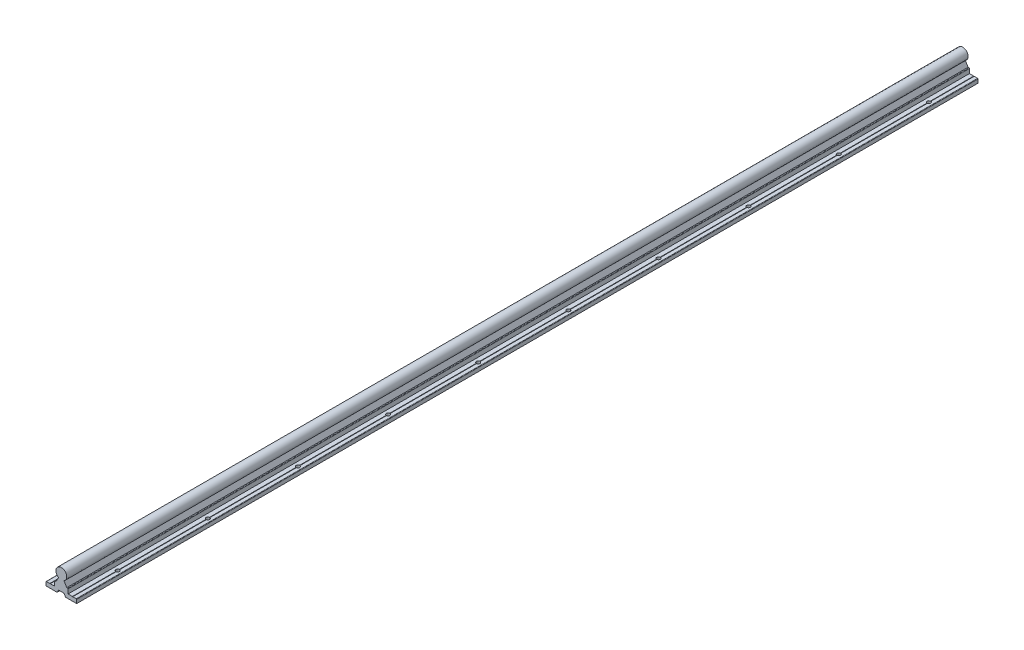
SolidWorks part; units mm, degrees
ref_plane "Front Plane" through (0, 0, 0) normal (0, 0, 1) x (1, 0, 0)
ref_plane "Top Plane" through (0, 0, 0) normal (0, 1, 0) x (1, 0, 0)
ref_plane "Right Plane" through (0, 0, 0) normal (1, 0, 0) x (0, 0, -1)
ref_plane "Plane1" through (0, 0, 0) normal (0, 0, -1) x (-1, 0, 0)
sketch "Sketch1" plane through (0, 0, 0) normal (0, 0, -1) x (-1, 0, 0)
  line L0 (-6.0022, -10.3962) -> (-17, -10.3962)
  line L1 (-17, -10.3962) -> (-17, -20.1962)
  line L2 (-17, -20.1962) -> (17, -20.1962)
  line L3 (17, -20.1962) -> (17, -10.3962)
  line L4 (17, -10.3962) -> (6.0022, -10.3962)
  line L5 (6.0022, -10.3962) -> (3, -5.1962)
  line L6 (-3, -5.1962) -> (-6.0022, -10.3962)
  arc A0 (3, -5.1962) -> (-3, -5.1962) centre (0, 0) ccw
  dimension "D1" = 6
  dimension "D2" = 10.9978
  dimension "D3" = 14
  dimension "D4" = 17
  dimension "D5" = 9.8
  dimension "D6" = 23.0022
  dimension "D7" = 34
  dimension "D8" = 15
extrude "Boss-Extrude1" add sketch "Sketch1" against normal blind 1000
sketch "Sketch2" plane through (0, 0, 1000) normal (0, 0, 1) x (1, 0, 0)
  line L0 (17, -10.3962) -> (7.5, -10.3962)
  line L1 (7.5, -10.3962) -> (7.5, -15.6962)
  line L2 (7.5, -15.6962) -> (17, -15.6962)
  line L3 (17, -15.6962) -> (17, -10.3962)
  line L4 (-17, -10.3962) -> (-6.0022, -10.3962) construction
  dimension "D1" = 1.4978
  dimension "D2" = 10.9978
  dimension "D3" = 5.3
extrude "Cut-Extrude1" cut sketch "Sketch2" against normal through all
sketch "Sketch3" plane through (0, 0, 1000) normal (0, 0, 1) x (1, 0, 0)
  line L0 (12.75, -15.6962) -> (12.25, -15.6962)
  line L1 (12.25, -15.6962) -> (12.5, -15.9462)
  line L2 (12.5, -15.9462) -> (12.75, -15.6962)
  line L3 (17, -15.6962) -> (17, -20.1962) construction
  line L4 (7.5, -15.6962) -> (17, -15.6962) construction
  dimension "D1" = 4.25
  dimension "D2" = 4.5
  dimension "D3" = 4.75
  dimension "D4" = 0.25
extrude "Cut-Extrude2" cut sketch "Sketch3" against normal through all
sketch "Sketch4" plane through (0, 0, 1000) normal (0, 0, 1) x (1, 0, 0)
  line L0 (12.25, -20.1962) -> (12.75, -20.1962)
  line L1 (12.75, -20.1962) -> (12.5, -19.9462)
  line L2 (12.5, -19.9462) -> (12.25, -20.1962)
  line L3 (7.5, -10.3962) -> (7.5, -15.6962) construction
  line L4 (7.5, -15.6962) -> (12.25, -15.6962) construction
  dimension "D1" = 4.75
  dimension "D2" = 5
  dimension "D3" = 5.25
  dimension "D4" = 4.25
  dimension "D5" = 4.5
extrude "Cut-Extrude3" cut sketch "Sketch4" against normal blind 400
sketch "Sketch5" plane through (0, 0, 1000) normal (0, 0, 1) x (1, 0, 0)
  line L0 (-4.7321, -20.1962) -> (4.7321, -20.1962)
  line L1 (4.7321, -20.1962) -> (3, -17.1962)
  line L2 (3, -17.1962) -> (-3, -17.1962)
  line L3 (-3, -17.1962) -> (-4.7321, -20.1962)
  line L4 (17, -15.6962) -> (17, -20.1962) construction
  line L5 (17, -20.1962) -> (12.75, -20.1962) construction
  dimension "D1" = 12.2679
  dimension "D2" = 14
  dimension "D3" = 20
  dimension "D4" = 21.7321
  dimension "D5" = 3
extrude "Cut-Extrude4" cut sketch "Sketch5" against normal through all
sketch "Sketch6" plane through (0, 0, 1000) normal (0, 0, 1) x (1, 0, 0)
  line L0 (-12.75, -20.1962) -> (-12.25, -20.1962)
  line L1 (-12.25, -20.1962) -> (-12.5, -19.9462)
  line L2 (-12.5, -19.9462) -> (-12.75, -20.1962)
  line L3 (17, -15.6962) -> (17, -20.1962) construction
  line L4 (17, -20.1962) -> (12.75, -20.1962) construction
  dimension "D1" = 29.25
  dimension "D2" = 29.5
  dimension "D3" = 29.75
  dimension "D4" = 0.25
extrude "Cut-Extrude5" cut sketch "Sketch6" against normal blind 400
sketch "Sketch7" plane through (0, 0, 1000) normal (0, 0, 1) x (1, 0, 0)
  line L0 (-17, -15.6962) -> (-7.5, -15.6962)
  line L1 (-7.5, -15.6962) -> (-7.5, -10.3962)
  line L2 (-7.5, -10.3962) -> (-17, -10.3962)
  line L3 (-17, -10.3962) -> (-17, -15.6962)
  line L4 (17, -15.6962) -> (17, -20.1962) construction
  line L5 (17, -20.1962) -> (12.75, -20.1962) construction
  dimension "D1" = 24.5
  dimension "D2" = 34
  dimension "D3" = 4.5
  dimension "D4" = 9.8
extrude "Cut-Extrude6" cut sketch "Sketch7" against normal through all
sketch "Sketch8" plane through (0, 0, 1000) normal (0, 0, 1) x (1, 0, 0)
  line L0 (-12.25, -15.6962) -> (-12.75, -15.6962)
  line L1 (-12.75, -15.6962) -> (-12.5, -15.9462)
  line L2 (-12.5, -15.9462) -> (-12.25, -15.6962)
  line L3 (-17, -20.1962) -> (-17, -15.6962) construction
  line L4 (-12.75, -20.1962) -> (-17, -20.1962) construction
  dimension "D1" = 4.25
  dimension "D2" = 4.5
  dimension "D3" = 4.75
  dimension "D4" = 4.25
  dimension "D5" = 4.5
extrude "Cut-Extrude7" cut sketch "Sketch8" against normal through all
ref_plane "Plane2" through (0, 0, 50) normal (0, 0, -1) x (-1, 0, 0)
sketch "Sketch9" plane through (0, 0, 50) normal (0, 0, -1) x (-1, 0, 0)
  line L0 (-14.5, -20.1962) -> (-12.5, -20.1962)
  line L1 (-12.5, -20.1962) -> (-12.5, -15.6962)
  line L2 (-12.5, -15.6962) -> (-14.5, -15.6962)
  line L3 (-14.5, -15.6962) -> (-14.5, -20.1962)
  line L4 (-12.5, -20.1962) -> (-12.5, -15.6962) construction
  dimension "D1" = 2
  dimension "D2" = 4.5
revolve "Cut-Revolve1" cut sketch "Sketch9" angle 360 about L4
ref_plane "Plane3" through (0, 0, 150) normal (0, 0, -1) x (-1, 0, 0)
ref_plane "Plane4" through (0, 0, 250) normal (0, 0, -1) x (-1, 0, 0)
ref_plane "Plane5" through (0, 0, 350) normal (0, 0, -1) x (-1, 0, 0)
sketch "Sketch13" plane through (0, 0, 50) normal (0, 0, -1) x (-1, 0, 0)
  line L0 (10.5, -20.1962) -> (12.5, -20.1962)
  line L1 (12.5, -20.1962) -> (12.5, -15.6962)
  line L2 (12.5, -15.6962) -> (10.5, -15.6962)
  line L3 (10.5, -15.6962) -> (10.5, -20.1962)
  line L4 (12.5, -20.1962) -> (12.5, -15.6962) construction
  dimension "D1" = 2
  dimension "D2" = 4.5
revolve "Cut-Revolve5" cut sketch "Sketch13" angle 360 about L4
fillet "Fillet1" radius 0.5 6 edges at (3, -17.1962, 500) (7.5, -10.3962, 500) (17, -15.6962, 500) (-17, -15.6962, 500) (-7.5, -10.3962, 500) (-3, -17.1962, 500)
other "Fill Pattern1" parameters "D5"=0, "D6"=0, "D1"=100, "D2"=60, "D3"=0, "D9"=10, "D7"=11, "D8"=2
